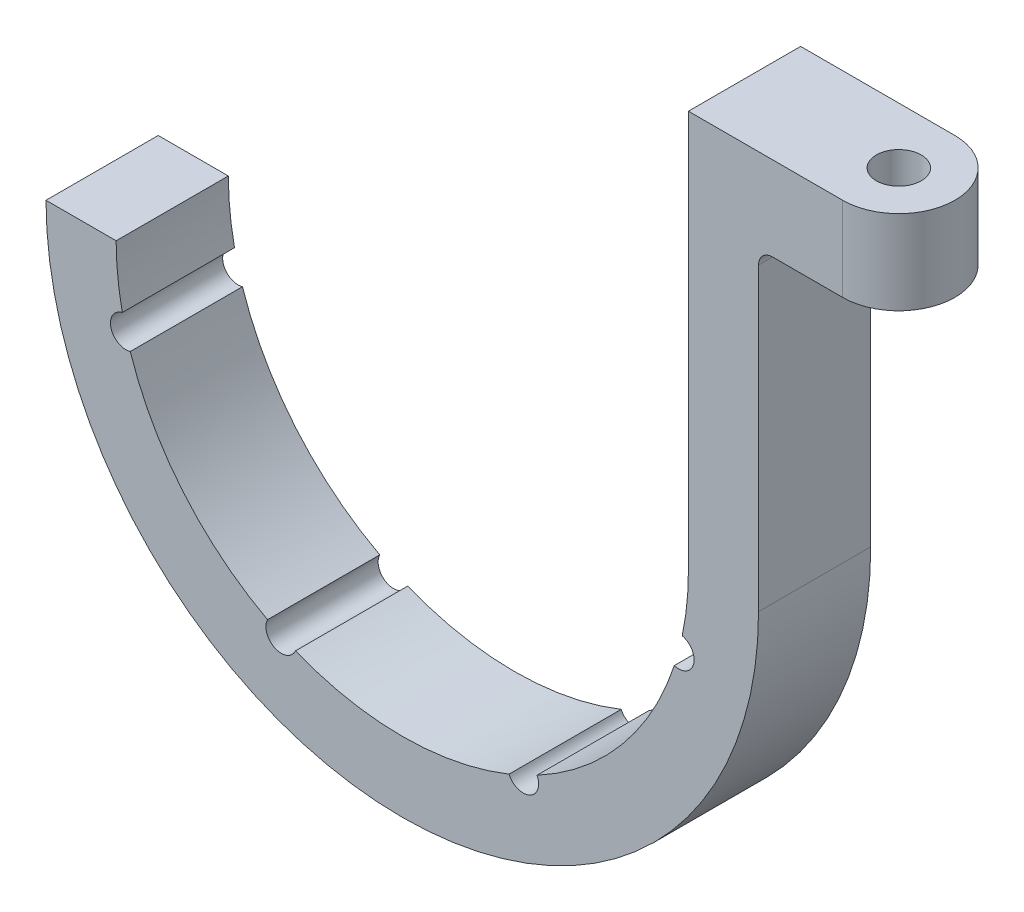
SolidWorks part; units mm, degrees
ref_plane "Front Plane" through (0, 0, 0) normal (0, 0, 1) x (1, 0, 0)
ref_plane "Top Plane" through (0, 0, 0) normal (0, 1, 0) x (1, 0, 0)
ref_plane "Right Plane" through (0, 0, 0) normal (1, 0, 0) x (0, 0, -1)
sketch "Sketch1" plane through (0, 0, 0) normal (0, 0, 1) x (1, 0, 0)
  line L0 (0, 41.3275) -> (0, -40.7068) construction
  line L1 (-59.5671, -15.961) -> (0, 0) construction
  line L2 (-25.915, -55.5749) -> (0, 0) construction
  line L3 (-20.4, 0) -> (-25.4, 0)
  line L4 (0, 20.4) -> (58.7265, 20.4) construction
  line L8 (20.4, 0) -> (20.4, 28.4)
  line L9 (20.4, 28.4) -> (25.4, 28.4)
  line L10 (25.4, 0) -> (25.4, 28.4)
  circle A0 centre (0, 0) radius 20.4
  circle A1 centre (0, 0) radius 25.4
  circle A2 centre (-19.7049, -5.2799) radius 1.1
  circle A3 centre (-8.6214, -18.4887) radius 1.1
  circle A4 centre (8.6214, -18.4887) radius 1.1
  circle A5 centre (19.7049, -5.2799) radius 1.1
  dimension "D1" = 5
  dimension "D2" = 40.8
  dimension "D5" = 2.2
  dimension "D6" = 2.2
  dimension "D3" = 50
  dimension "D4" = 25
  dimension "D7" = 8
extrude "Boss-Extrude1" add sketch "Sketch1" along normal blind 8
sketch "Sketch2" plane through (0, 28.4, 0) normal (0, 1, 0) x (1, 0, 0)
  line L0 (25.4, -8) -> (25.4, 0)
  line L1 (25.4, 0) -> (31.4, 0)
  line L2 (31.4, -8) -> (25.4, -8)
  arc A0 (31.4, 0) -> (31.4, -8) centre (31.4, -4) cw
  circle A1 centre (31.4, -4) radius 1.6
  dimension "D1" = 3.2
  dimension "D2" = 6
extrude "Boss-Extrude2" add sketch "Sketch2" against normal blind 6
fillet "Fillet1" radius 1 1 edges at (25.4, 22.4, 4)
